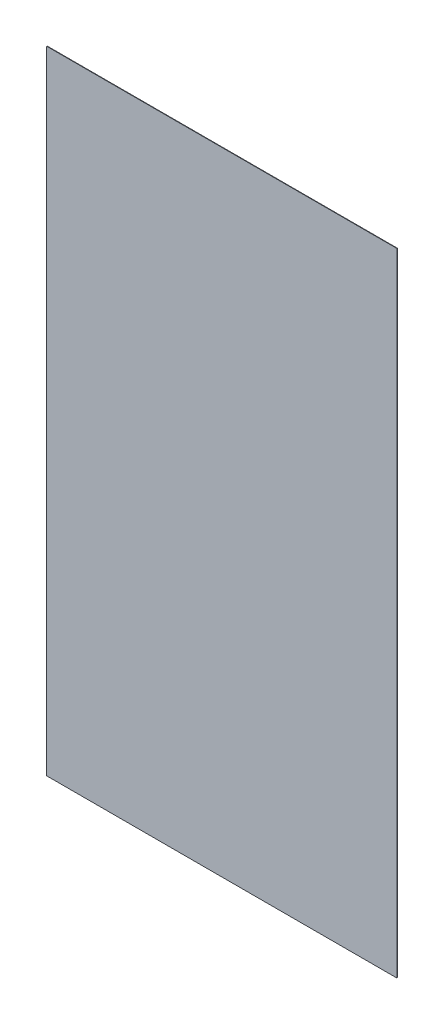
SolidWorks part; units mm, degrees
ref_plane "Front Plane" through (0, 0, 0) normal (0, 0, 1) x (1, 0, 0)
ref_plane "Top Plane" through (0, 0, 0) normal (0, 1, 0) x (1, 0, 0)
ref_plane "Right Plane" through (0, 0, 0) normal (1, 0, 0) x (0, 0, -1)
sketch "Sketch1" plane through (0, 0, 0) normal (0, 0, 1) x (1, 0, 0)
  line L553 (3.81, 0) -> (-3.81, 0)
  line L554 (-3.81, 0) -> (-3.81, 13.754)
  line L555 (-3.81, 13.754) -> (3.81, 13.754)
  line L556 (3.81, 13.754) -> (3.81, 0)
extrude "Boss-Extrude1" add sketch "Sketch1" along normal blind 0.01
